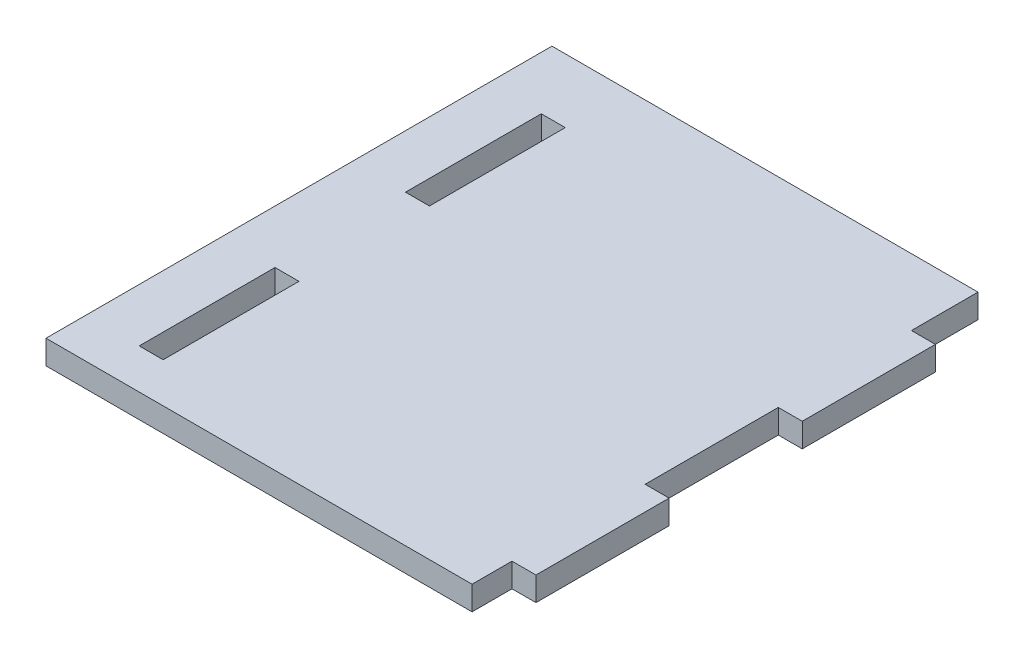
SolidWorks part; units mm, degrees
ref_plane "Front Plane" through (0, 0, 0) normal (0, 0, 1) x (1, 0, 0)
ref_plane "Top Plane" through (0, 0, 0) normal (0, 1, 0) x (1, 0, 0)
ref_plane "Right Plane" through (0, 0, 0) normal (1, 0, 0) x (0, 0, -1)
sketch "Sketch1" plane through (0, 0, 0) normal (0, 1, 0) x (1, 0, 0)
  line L0 (109.2631, -51.2506) -> (118.2631, -51.2506)
  line L1 (-416.2132, 423.5798) -> (519.3457, 423.5798)
  line L2 (-416.2132, 423.5798) -> (-416.2132, -320.4473)
  line L3 (-416.2132, -320.4473) -> (519.3457, -320.4473)
  line L4 (519.3457, 423.5798) -> (519.3457, -320.4473)
  line L5 (-50.7369, 123.7494) -> (109.2631, 123.7494)
  line L6 (-50.7369, 123.7494) -> (-50.7369, -66.2506)
  line L7 (-50.7369, -66.2506) -> (109.2631, -66.2506)
  line L8 (109.2631, 123.7494) -> (109.2631, 98.7494)
  line L9 (118.2631, -51.2506) -> (118.2631, -1.2506)
  line L10 (118.2631, -1.2506) -> (109.2631, -1.2506)
  line L11 (118.2631, 98.7494) -> (109.2631, 98.7494)
  line L12 (118.2631, 48.7494) -> (118.2631, 98.7494)
  line L13 (109.2631, 48.7494) -> (118.2631, 48.7494)
  line L14 (109.2631, -51.2506) -> (109.2631, -66.2506)
  line L15 (109.2631, 48.7494) -> (109.2631, -1.2506)
  dimension "D1" = 190
  dimension "D2" = 50
  dimension "D3" = 9
  dimension "D4" = 15
  dimension "D6" = 160
  dimension "D5" = 2
extrude "Boss-Extrude1" add sketch "Sketch1" along normal blind 9 contours L6 L7 L14 L0 L9 L10 L15 L13 L12 L11 L8 L5
sketch "Sketch2" plane through (0, 0, 0) normal (0, 1, 0) x (1, 0, 0)
  line L0 (-50.7369, 123.7494) -> (-50.7369, -66.2506) construction
  line L1 (-30.7369, -0.2506) -> (-21.7369, -0.2506)
  line L2 (-30.7369, -0.2506) -> (-30.7369, -51.2506)
  line L3 (-30.7369, -51.2506) -> (-21.7369, -51.2506)
  line L4 (-21.7369, -0.2506) -> (-21.7369, -51.2506)
  line L5 (-50.7369, -66.2506) -> (109.2631, -66.2506) construction
  dimension "D1" = 9
  dimension "D2" = 51
  dimension "D3" = 20
  dimension "D4" = 15
extrude "Cut-Extrude3" cut sketch "Sketch2" along normal through all
pattern_linear "LPattern2" count 2 spacing 100 along (0, 0, -1) of "Cut-Extrude3"
